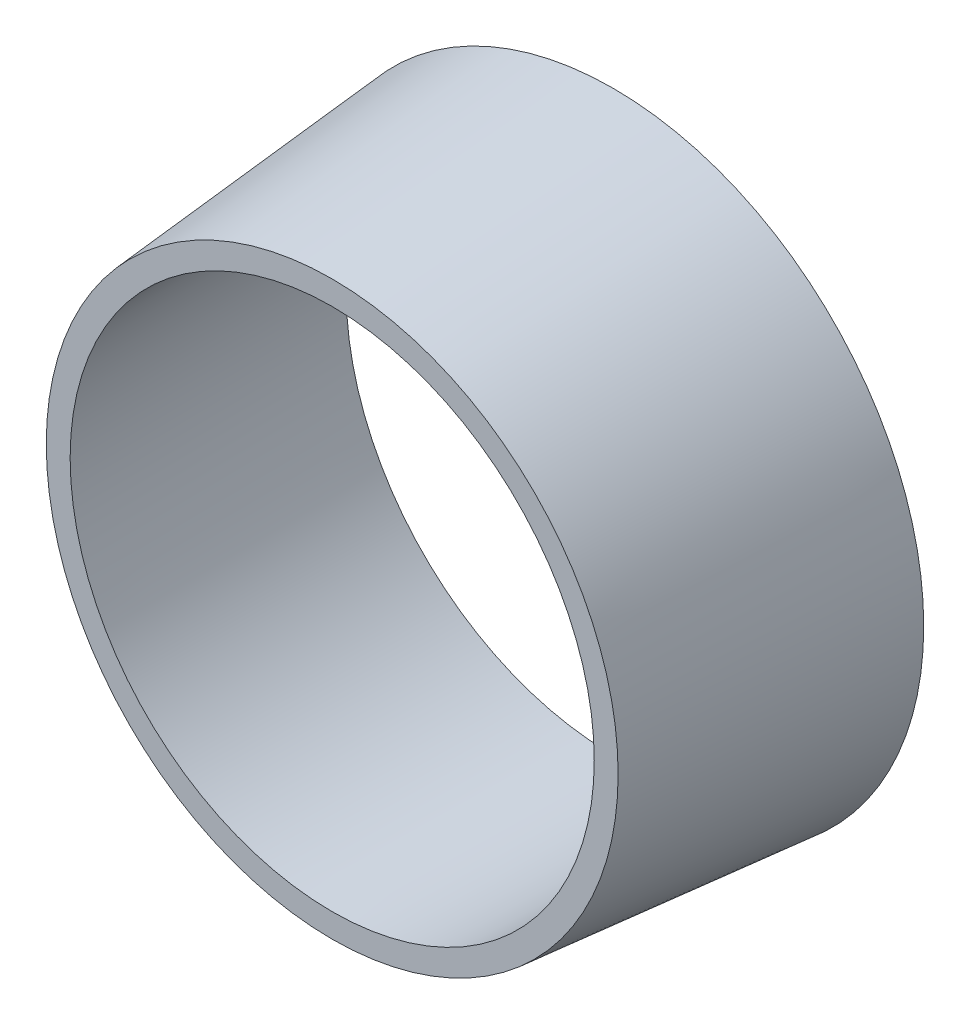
SolidWorks part; units mm, degrees
ref_plane "Plan de face" through (0, 0, 0) normal (0, 0, 1) x (1, 0, 0)
ref_plane "Plan de dessus" through (0, 0, 0) normal (0, 1, 0) x (1, 0, 0)
ref_plane "Plan de droite" through (0, 0, 0) normal (1, 0, 0) x (0, 0, -1)
sketch "Esquisse1" plane through (0, 0, 0) normal (0, 0, 1) x (1, 0, 0)
  circle A0 centre (0, 0) radius 5.525
  dimension "D1" = 11.05
extrude "Boss.-Extru.1" add sketch "Esquisse1" along normal blind 5 draft 5
sketch "Esquisse2" plane through (0, 0, 0) normal (0, 0, -1) x (-1, 0, 0)
  circle A0 centre (0, 0) radius 4.75
  dimension "D1" = 9.5
extrude "Enlèv. mat.-Extru.1" cut sketch "Esquisse2" against normal blind 10 draft 1
